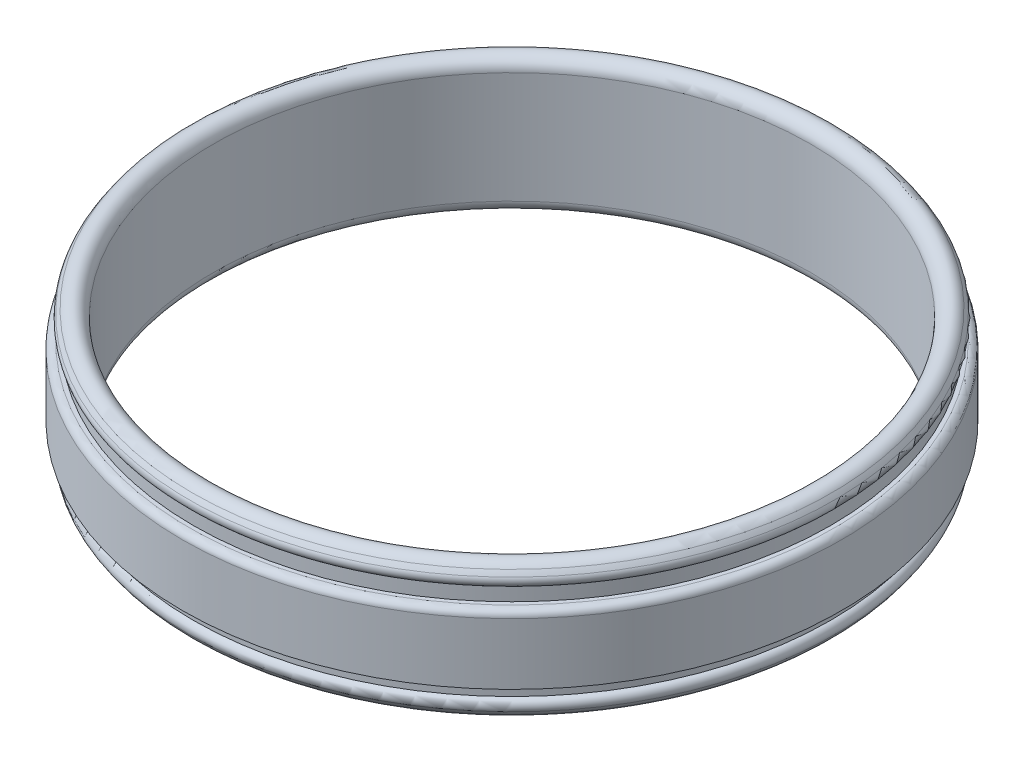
SolidWorks part; units mm, degrees
other "Camera1"
ref_plane "Front Plane" through (0, 0, 0) normal (0, 0, 1) x (1, 0, 0)
ref_plane "Top Plane" through (0, 0, 0) normal (0, 1, 0) x (1, 0, 0)
ref_plane "Right Plane" through (0, 0, 0) normal (1, 0, 0) x (0, 0, -1)
sketch "Sketch1" plane through (0, 0, 0) normal (0, 0, 1) x (1, 0, 0)
  line L0 (0, 0) -> (0, 14.6885) construction
  line L1 (64.5905, 0) -> (64.5905, 33.5598)
  line L2 (64.5905, 33.5598) -> (71.2052, 33.5598)
  line L3 (71.2052, 33.5598) -> (71.2052, 0)
  line L4 (71.2052, 0) -> (64.5905, 0)
revolve "Revolve1" add sketch "Sketch1" angle 360 about L0
fillet "Fillet1" radius 10 2 edges at (0, 0, -71.2052) (0, 33.5598, -71.2052)
fillet "Fillet2" radius 2.5 2 edges at (0, 33.5598, -64.5905) (0, 0, -64.5905)
sketch "Sketch3" plane through (0, 0, 0) normal (0, 0, 1) x (1, 0, 0)
  line L0 (-71.2052, 24.1503) -> (71.2052, 24.1503) construction
  line L1 (68.854, 24.1503) -> (82.3558, 24.1503)
  line L2 (68.854, 24.1503) -> (68.854, 27.1503)
  line L3 (68.854, 27.1503) -> (82.3558, 27.1503)
  line L4 (82.3558, 24.1503) -> (82.3558, 27.1503)
  line L5 (-71.2052, 9.4096) -> (71.2052, 9.4096) construction
  line L6 (68.854, 9.4096) -> (82.3558, 9.4096)
  line L7 (68.854, 9.4096) -> (68.854, 6.4096)
  line L8 (68.854, 6.4096) -> (82.3558, 6.4096)
  line L9 (82.3558, 9.4096) -> (82.3558, 6.4096)
  line L10 (0, 0) -> (0, 44.0508) construction
  dimension "D1" = 3
  dimension "D2" = 3
revolve "Cut-Revolve1" cut sketch "Sketch3" angle 360 about L10
fillet "Fillet4" radius 1.5 3 edges at (0, 6.4096, -70.7446) (0, 24.1503, -71.2052) (0, 27.1503, 70.7446)
